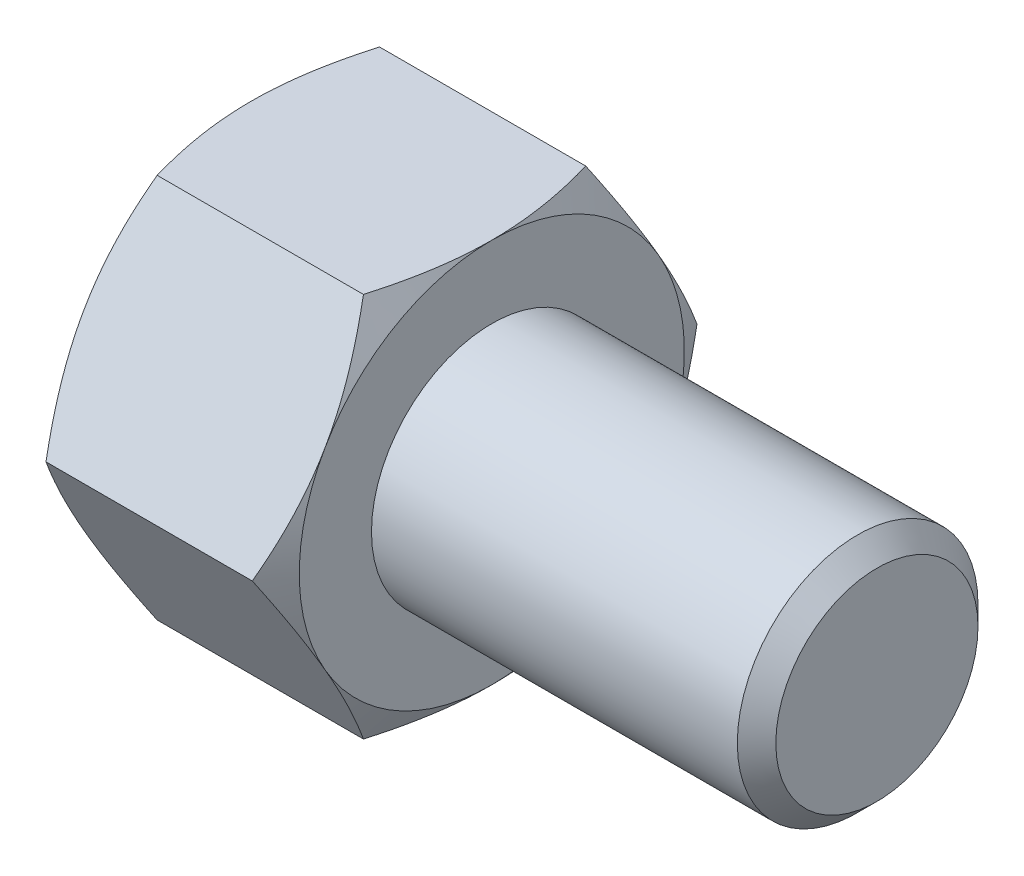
SolidWorks part; units mm, degrees
ref_plane "Front Plane" through (0, 0, 0) normal (0, 0, 1) x (1, 0, 0)
ref_plane "Top Plane" through (0, 0, 0) normal (0, 1, 0) x (1, 0, 0)
ref_plane "Right Plane" through (0, 0, 0) normal (1, 0, 0) x (0, 0, -1)
sketch "Sketch1" plane through (0, 0, 0) normal (1, 0, 0) x (0, 0, -1)
  line L1 (2.3094, 4) -> (-2.3094, 4)
  line L2 (-2.3094, 4) -> (-4.6188, 0)
  line L3 (-4.6188, 0) -> (-2.3094, -4)
  line L4 (-2.3094, -4) -> (2.3094, -4)
  line L5 (2.3094, -4) -> (4.6188, 0)
  line L6 (4.6188, 0) -> (2.3094, 4)
  circle A0 centre (0, 0) radius 4 construction
  dimension "D1" = 8
extrude "Extrude2" add sketch "Sketch1" along normal mid plane 5
sketch "Sketch2" plane through (0, 0, 0) normal (0, 0, 1) x (1, 0, 0)
  line L0 (-2.5, 4) -> (-1, 6.5981)
  line L1 (-2.5, 7) -> (-2.5, 4)
  line L3 (0, 0) -> (50000, 0) construction
  arc A0 (-1, 6.5981) -> (-2.5, 7) centre (-1.6962, 7) ccw
  dimension "D1" = 30
  dimension "D2" = 3
revolve "Cut-Revolve1" cut sketch "Sketch2" angle 360 about L3
mirror "Mirror1" about plane through (0, 0, 0) normal (1, 0, 0) of "Cut-Revolve1"
sketch "Sketch3" plane through (-2.5, 0, 0) normal (-1, 0, 0) x (0, 0, 1)
  circle A0 centre (0, 0) radius 2.1
  dimension "D1" = 4.2
extrude "Extrude3" cut sketch "Sketch3" against normal blind 3
sketch "Sketch4" plane through (0, 0, 0) normal (0, 0, 1) x (1, 0, 0)
  line L0 (0.5, 0) -> (0.5, 2.1)
  line L1 (2.1427, 0) -> (-2.1427, 0) construction
  line L2 (0.5, 2.1) -> (1.7124, 0)
  line L3 (1.7124, 0) -> (0.5, 0)
  line L4 (-2.5, 2) -> (-2.5, -2) construction
  point P4 (-2.5, 0)
  dimension "D1" = 30
  dimension "D2" = 2.1
  dimension "D3" = 3
revolve "Cut-Revolve2" cut sketch "Sketch4" angle 360 about L3
sketch "Sketch5" plane through (2.5, 0, 0) normal (1, 0, 0) x (0, 0, -1)
  circle A0 centre (0, 0) radius 2.5
  dimension "D1" = 5
extrude "Extrude4" add sketch "Sketch5" along normal blind 8
chamfer "Chamfer1" distance 0.4 angle 45 1 edges at (10.5, 0, -2.5)
equation "\"D2@Sketch4\" = \"D1@Sketch3\"/2"
